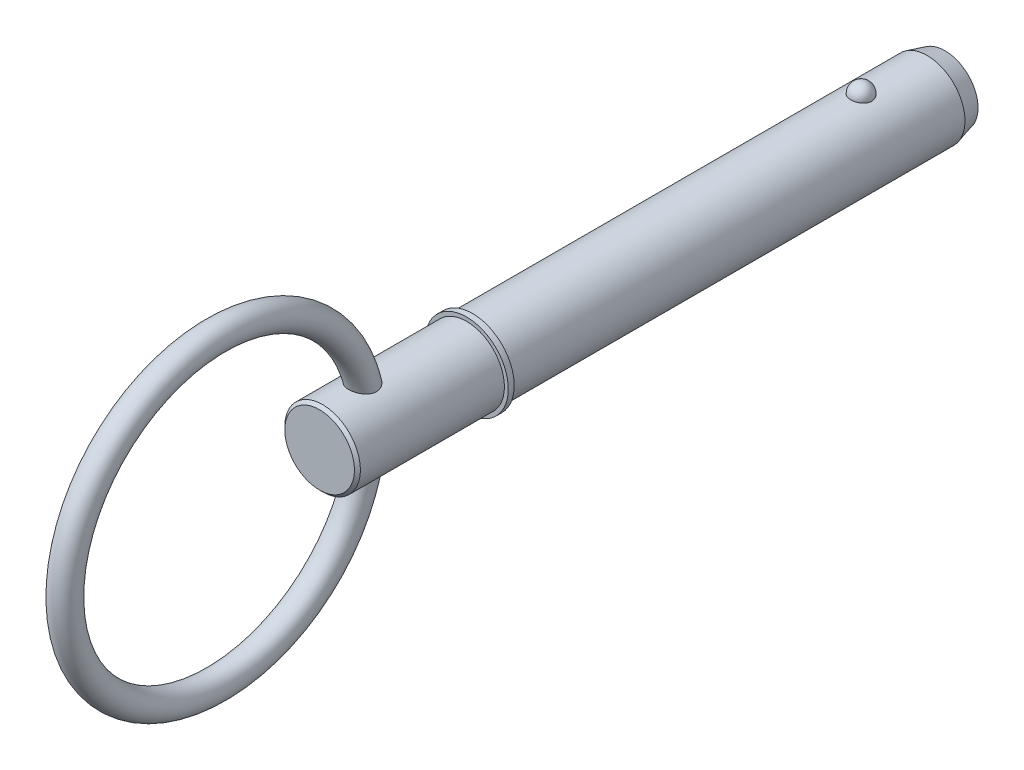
SolidWorks part; units mm, degrees
ref_plane "Front Plane" through (0, 0, 0) normal (0, 0, 1) x (1, 0, 0)
ref_plane "Top Plane" through (0, 0, 0) normal (0, 1, 0) x (1, 0, 0)
ref_plane "Right Plane" through (0, 0, 0) normal (1, 0, 0) x (0, 0, -1)
sketch "Sketch2" plane through (0, 0, 0) normal (0, 0, 1) x (1, 0, 0)
  circle A0 centre (0, 0) radius 6.35
  point P3 (0, 6.35)
  dimension "D1" = 12.7
extrude "Boss-Extrude1" add sketch "Sketch2" along normal blind 63.5
sketch "Sketch3" plane through (0, 0, 0) normal (0, 0, -1) x (-1, 0, 0)
  circle A0 centre (0, 0) radius 6.35
  dimension "D1" = 12.7
extrude "Boss-Extrude2" add sketch "Sketch3" along normal blind 15.88
chamfer "Chamfer1" distance 3 angle 15 1 edges at (-6.35, 0, -15.88)
sketch "Sketch18" plane through (0, 0, 0) normal (1, 0, 0) x (0, 0, -1)
  line L0 (12.88, 6.35) -> (-63.5, 6.35) construction
  line L1 (1.78, 8.13) -> (1.78, 4.57)
  line L2 (-63.5, -6.35) -> (12.88, -6.35) construction
  arc A0 (1.78, 8.13) -> (1.78, 4.57) centre (1.78, 6.35) ccw
  point P4 (0, 6.35)
  dimension "D1" = 14.48
revolve "Revolve1" add sketch "Sketch18" angle 360 about L1
sketch "Sketch19" plane through (0, 0, 0) normal (1, 0, 0) x (0, 0, -1)
  line L0 (-33.7288, 0) -> (-46.4542, 0) construction
sketch "Sketch20" plane through (0, 0, 0) normal (1, 0, 0) x (0, 0, -1)
  line L0 (-63.5, 0) -> (-63.5, 7)
  line L1 (-63.5, 6.35) -> (-63.5, -6.35) construction
  line L2 (-63.5, 7) -> (-64.5, 7)
  line L3 (-64.5, 7) -> (-64.5, 0)
  line L4 (-33.7288, 0) -> (-46.4542, 0) construction
  line L5 (-64.5, 0) -> (-63.5, 0)
  dimension "D1" = 7
  dimension "D2" = 1
revolve "Revolve2" add sketch "Sketch20" angle 360 about L0
sketch "Sketch21" plane through (0, 0, 63.5) normal (0, 0, -1) x (-1, 0, 0)
  circle A0 centre (0, 0) radius 6.35
  dimension "D1" = 12.7
extrude "Boss-Extrude3" add sketch "Sketch21" against normal blind 25.7
chamfer "Chamfer2" distance 0.5 angle 45 1 edges at (-6.35, 0, 89.2)
sketch "Sketch23" plane through (0, 0, 0) normal (1, 0, 0) x (0, 0, -1)
  line L0 (-89.2, 5.85) -> (-89.2, -5.85) construction
  circle A0 centre (-106.6, 0) radius 25.4
  point P2 (-81.2, 0)
  dimension "D1" = 50.8
  dimension "D2" = 8
sketch "Sketch24" plane through (0, 0, 0) normal (0, 1, 0) x (1, 0, 0)
  circle A0 centre (0, -81.2) radius 2.25
  dimension "D1" = 4.5
sweep "Sweep1" add profiles "Sketch24" path "Sketch23"
